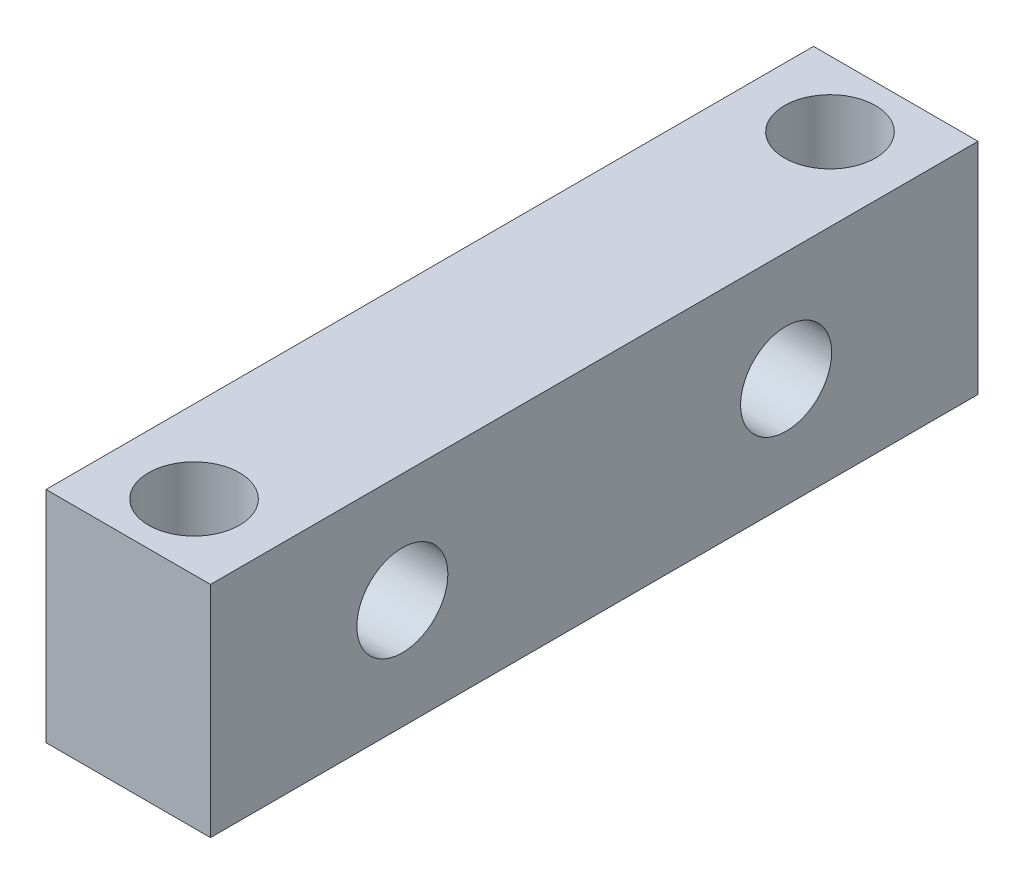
SolidWorks part; units mm, degrees
ref_plane "Plan de face" through (0, 0, 0) normal (0, 0, 1) x (1, 0, 0)
ref_plane "Plan de dessus" through (0, 0, 0) normal (0, 1, 0) x (1, 0, 0)
ref_plane "Plan de droite" through (0, 0, 0) normal (1, 0, 0) x (0, 0, -1)
sketch "Esquisse1" plane through (0, 0, 0) normal (1, 0, 0) x (0, 0, -1)
  line L1 (0, 0) -> (70, 0)
  line L2 (0, 0) -> (0, 20)
  line L3 (0, 20) -> (70, 20)
  line L4 (70, 0) -> (70, 20)
  dimension "D1" = 20
  dimension "D2" = 70
extrude "Boss.-Extru.1" add sketch "Esquisse1" along normal blind 15
sketch "Esquisse2" plane through (15, 0, 0) normal (1, 0, 0) x (0, 0, -1)
  line L0 (0, 0) -> (70, 0) construction
  line L1 (17.5, 10) -> (52.5, 10) construction
  line L2 (70, 20) -> (0, 20) construction
  circle A0 centre (17.5, 10) radius 4.15
  circle A1 centre (52.5, 10) radius 4.15
  point P8 (35, 20)
  point P9 (35, 10)
  dimension "D1" = 8.3
  dimension "D2" = 35
  dimension "D3" = 10
extrude "Enlèv. mat.-Extru.1" cut sketch "Esquisse2" against normal through all
sketch "Esquisse3" plane through (0, 20, 0) normal (0, 1, 0) x (1, 0, 0)
  line L0 (15, 0) -> (0, 0) construction
  line L1 (15, 70) -> (0, 70) construction
  circle A0 centre (7.5, 6) radius 4.15
  circle A1 centre (7.5, 64) radius 4.15
  point P6 (7.5, 0)
  dimension "D1" = 8.3
  dimension "D2" = 6
  dimension "D3" = 6
extrude "Enlèv. mat.-Extru.2" cut sketch "Esquisse3" against normal through all
